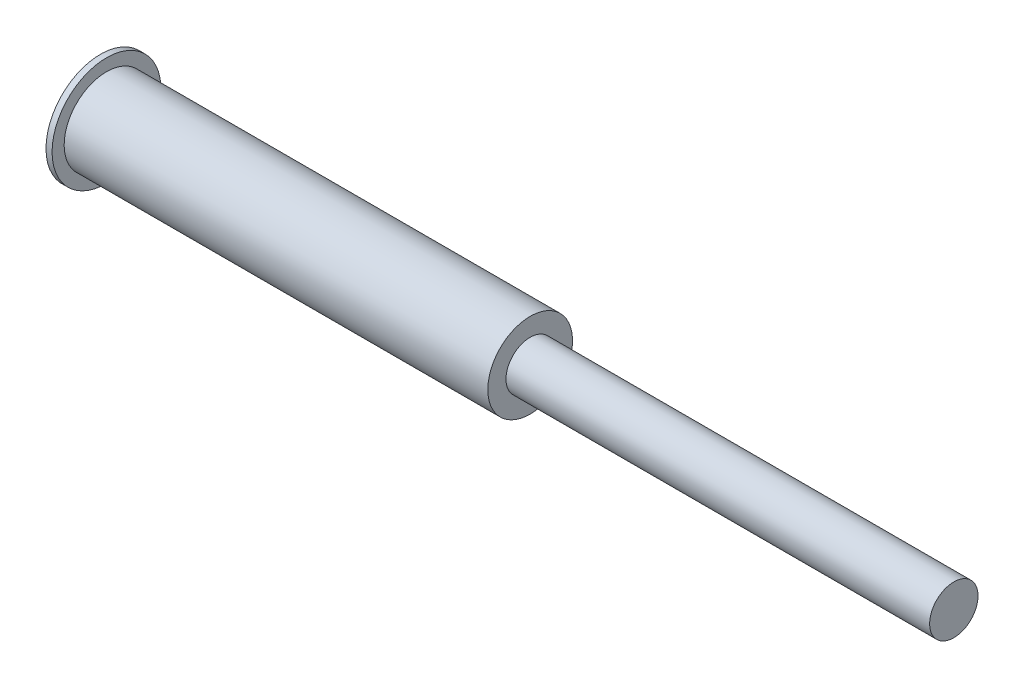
SolidWorks part; units mm, degrees
ref_plane "前视基准面" through (0, 0, 0) normal (0, 0, 1) x (1, 0, 0)
ref_plane "上视基准面" through (0, 0, 0) normal (0, 1, 0) x (1, 0, 0)
ref_plane "右视基准面" through (0, 0, 0) normal (1, 0, 0) x (0, 0, -1)
other "Configuration Table"
sketch "草图1" plane through (0, 0, 0) normal (0, 0, 1) x (1, 0, 0)
  line L0 (0, 0) -> (35.5, 0) construction
  line L1 (35.5, 2) -> (35.5, 3.5)
  line L2 (35.5, 3.5) -> (0.5, 3.5)
  line L3 (0.5, 3.5) -> (0.5, 4.5)
  line L4 (0.5, 4.5) -> (0, 4.5)
  line L5 (0, 4.5) -> (0, 0)
  line L6 (0, 0) -> (35.5, 0)
  line L7 (35.5, 2) -> (70.5, 2)
  line L8 (70.5, 2) -> (70.5, 0)
  line L9 (70.5, 0) -> (35.5, 0)
  dimension "D1" = 35
  dimension "D2" = 3.5
  dimension "D3" = 0.5
  dimension "D4" = 4.5
  dimension "D5" = 2
  dimension "D6" = 35
revolve "旋转1" add sketch "草图1" angle 360 about L0
